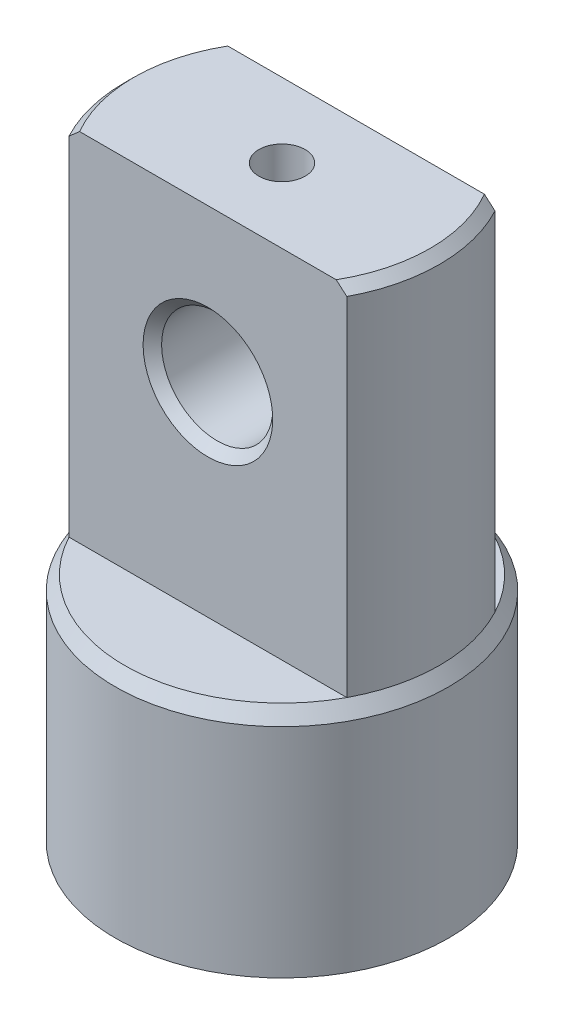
SolidWorks part; units mm, degrees
ref_plane "Front Plane" through (0, 0, 0) normal (0, 0, 1) x (1, 0, 0)
ref_plane "Top Plane" through (0, 0, 0) normal (0, 1, 0) x (1, 0, 0)
ref_plane "Right Plane" through (0, 0, 0) normal (1, 0, 0) x (0, 0, -1)
sketch "Sketch1" plane through (0, 0, 0) normal (0, 0, 1) x (1, 0, 0)
  line L0 (0, 0) -> (18, 0)
  line L1 (18, 0) -> (18, 23.5)
  line L4 (17, 25) -> (17, 63.5)
  line L5 (17, 63.5) -> (0, 63.5)
  line L6 (0, 0) -> (0, 63.5) construction
  line L7 (0, 0) -> (0, 63.5)
  line L8 (17, 25) -> (18, 23.5)
  dimension "D1" = 36
  dimension "D2" = 40
  dimension "D3" = 34
  dimension "D4" = 23.5
  dimension "D5" = 38.5
revolve "Revolve1" add sketch "Sketch1" angle 360 about L6
sketch "Sketch2" plane through (0, 63.5, 0) normal (0, 1, 0) x (1, 0, 0)
  line L1 (5.7735, 0) -> (2.8868, 5)
  line L2 (2.8868, 5) -> (-2.8868, 5)
  line L3 (-2.8868, 5) -> (-5.7735, 0)
  line L4 (-5.7735, 0) -> (-2.8868, -5)
  line L5 (-2.8868, -5) -> (2.8868, -5)
  line L6 (2.8868, -5) -> (5.7735, 0)
  circle A0 centre (0, 0) radius 5 construction
  dimension "D1" = 10
extrude "Cut-Extrude2" [suppressed] cut sketch "Sketch2" against normal blind 8
sketch "Sketch3" plane through (0, 63.5, 0) normal (0, 1, 0) x (-1, 0, 0)
  line L0 (0, -8) -> (0, 8) construction
  line L1 (16.1245, -8) -> (-16.1245, -8)
  line L3 (16.1245, 8) -> (-16.1245, 8)
  circle A0 centre (0, 0) radius 18 construction
  arc A1 (16.1245, 8) -> (-16.1245, 8) centre (0, 0) ccw
  arc A2 (-16.1245, -8) -> (16.1245, -8) centre (0, 0) ccw
  dimension "D2" = 16
extrude "Cut-Extrude3" cut sketch "Sketch3" against normal blind 38.5
chamfer "Chamfer1" distance 1 angle 45 2 edges at (17, 63.5, 0) (-17, 63.5, 0)
hole_wizard "Ø12.0 (12) Diameter Hole1" positions "Sketch5" profile "Sketch4" hole size "Ø12.0" standard "ISO"
sketch "Sketch5" plane through (0, 0, 8) normal (0, 0, 1) x (1, 0, 0)
  line L0 (13.8564, 63.5) -> (-13.8564, 63.5) construction
  point P0 (0, 47)
  dimension "D1" = 16.5
sketch "Sketch4" plane through (0, 47, 8) normal (1, 0, 0) x (0, -1, 0)
  line L0 (0, 0) -> (0, 16)
  line L1 (0, 16) -> (6, 16)
  line L2 (6, 16) -> (6, 0)
  line L5 (6, 0) -> (0, 0)
  line L11 (0, -6.35) -> (0, 107.95) construction
  dimension "Thru Hole Dia." = 12
  dimension "Thru Hole Depth" = 16
chamfer "Chamfer2" distance 1 angle 45 2 edges at (6, 47, -8) (6, 47, 8)
hole_wizard "M6 Tapped Hole1" positions "Sketch7" profile "Sketch6" tap size "M6" standard "ISO"
sketch "Sketch7" plane through (0, 63.5, 0) normal (0, 1, 0) x (-1, 0, 0)
  point P0 (0, 0)
sketch "Sketch6" plane through (0, 63.5, 0) normal (1, 0, 0) x (0, 0, 1)
  line L0 (0, 0) -> (0, 10.5)
  line L1 (0, 10.5) -> (2.5, 10.5)
  line L2 (2.5, 10.5) -> (2.5, 0)
  line L5 (2.5, 0) -> (0, 0)
  line L11 (0, -6.35) -> (0, 107.95) construction
  dimension "Thru Tap Drill Dia." = 5
  dimension "Thru Tap Drill Depth" = 10.5
